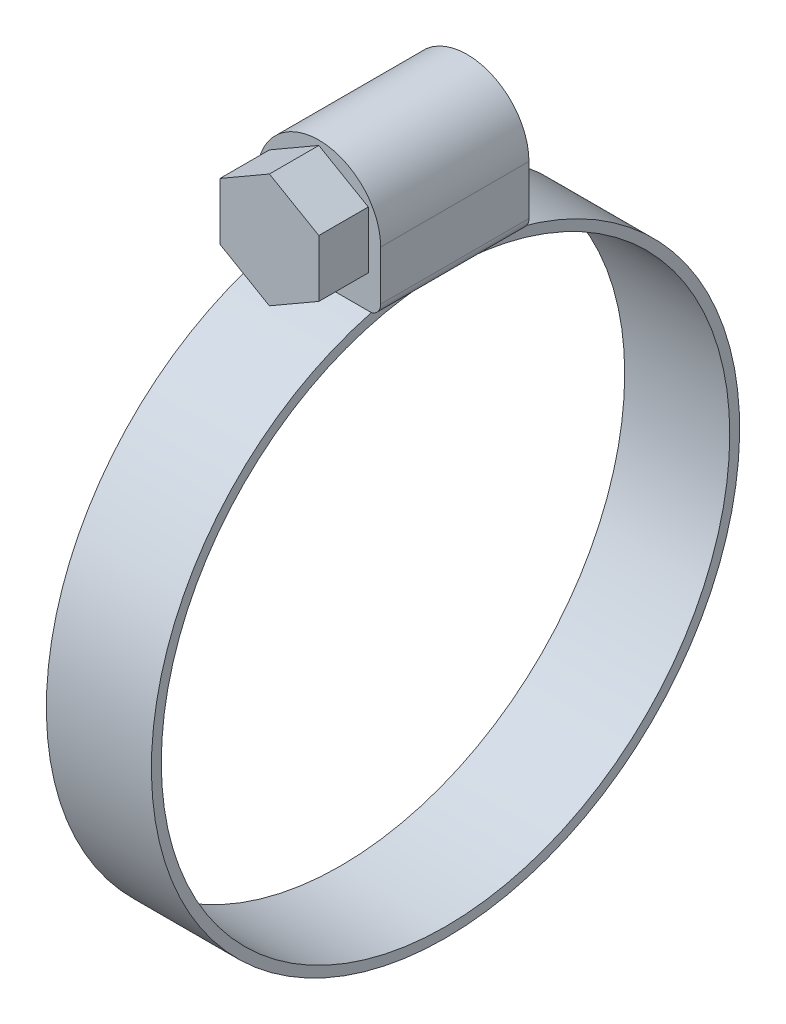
SolidWorks part; units mm, degrees
ref_plane "Спереди" through (0, 0, 0) normal (0, 0, 1) x (1, 0, 0)
ref_plane "Сверху" through (0, 0, 0) normal (0, 1, 0) x (1, 0, 0)
ref_plane "Справа" through (0, 0, 0) normal (1, 0, 0) x (0, 0, -1)
sketch "Эскиз1" plane through (0, 0, 0) normal (0, 0, 1) x (1, 0, 0)
  line L0 (0, 0) -> (8.5, 0) construction
  line L1 (0, 23.8) -> (8.5, 23.8)
  line L2 (0, 23.8) -> (0, 23)
  line L3 (0, 23) -> (8.5, 23)
  line L4 (8.5, 23.8) -> (8.5, 23)
  dimension "D1" = 0.8
  dimension "D2" = 8.5
  dimension "D3" = 46
revolve "Повернуть1" add sketch "Эскиз1" angle 360 about L0
sketch "Эскиз2" plane through (0, 0, 0) normal (0, 0, 1) x (1, 0, 0)
  line L1 (4.25, 23) -> (4.25, 28) construction
  line L2 (8.5, 23) -> (0, 23) construction
  line L3 (-0.75, 28) -> (-0.75, 24)
  line L4 (0.25, 23) -> (8.25, 23)
  line L5 (9.25, 24) -> (9.25, 28)
  arc A0 (9.25, 28) -> (-0.75, 28) centre (4.25, 28) ccw
  arc A1 (8.25, 23) -> (9.25, 24) centre (8.25, 24) ccw
  arc A2 (-0.75, 24) -> (0.25, 23) centre (0.25, 24) ccw
  dimension "D1" = 10
  dimension "D2" = 1
extrude "Бобышка-Вытянуть1" add sketch "Эскиз2" along normal mid plane 12
sketch "Эскиз3" plane through (0, 0, 6) normal (0, 0, 1) x (1, 0, 0)
  line L1 (8.25, 25.6906) -> (8.25, 30.3094)
  line L2 (8.25, 30.3094) -> (4.25, 32.6188)
  line L3 (4.25, 32.6188) -> (0.25, 30.3094)
  line L4 (0.25, 30.3094) -> (0.25, 25.6906)
  line L5 (0.25, 25.6906) -> (4.25, 23.3812)
  line L6 (4.25, 23.3812) -> (8.25, 25.6906)
  circle A0 centre (4.25, 28) radius 4 construction
  arc A1 (9.25, 28) -> (-0.75, 28) centre (4.25, 28) ccw construction
  dimension "D1" = 8
extrude "Бобышка-Вытянуть2" add sketch "Эскиз3" along normal blind 4
